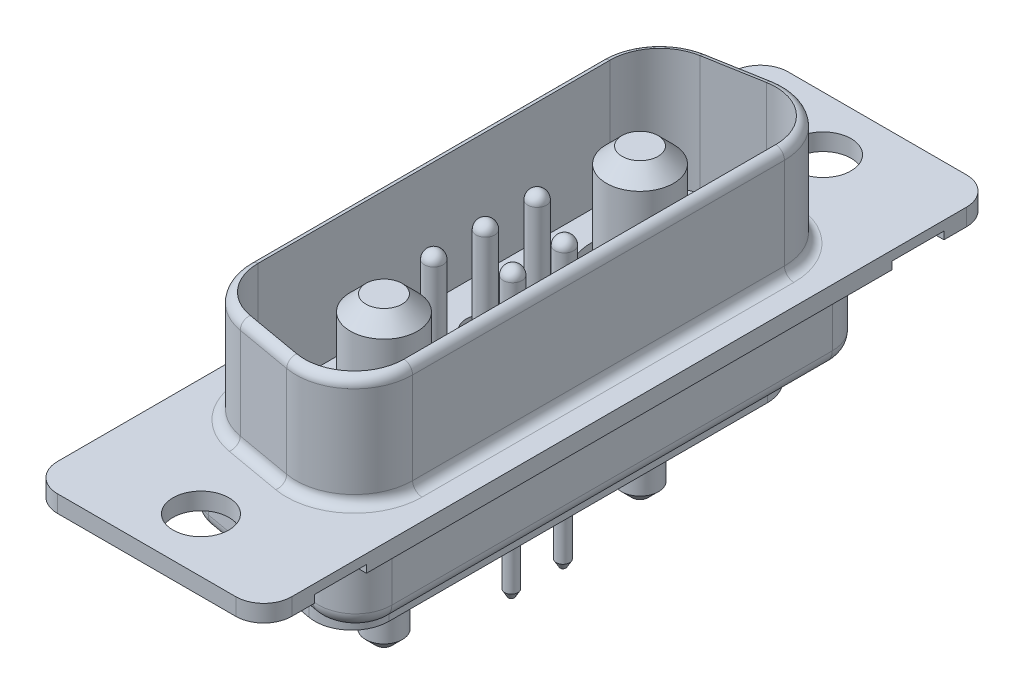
SolidWorks part; units mm, degrees
ref_plane "Front Plane" through (0, 0, 0) normal (0, 0, 1) x (1, 0, 0)
ref_plane "Top Plane" through (0, 0, 0) normal (0, 1, 0) x (1, 0, 0)
ref_plane "Right Plane" through (0, 0, 0) normal (1, 0, 0) x (0, 0, -1)
imported_body "Imported1"
sketch "Sketch1" plane through (0, 0, 0) normal (0, -1, 0) x (1, 0, 0)
  circle A0 centre (0, 16.6624) radius 2.519
  circle A1 centre (0, -16.6624) radius 2.3749
extrude "Cut-Extrude1" cut sketch "Sketch1" along normal through all
sketch "Sketch2" plane through (0, 0.9144, 0) normal (0, 1, 0) x (1, 0, 0)
  circle A0 centre (0, 16.6624) radius 2.3749
  circle A1 centre (0, -16.6624) radius 2.3749
extrude "Cut-Extrude2" cut sketch "Sketch2" along normal through all
sketch "Sketch5" plane through (0, 0, 0) normal (0, -1, 0) x (1, 0, 0)
  line L0 (0, 0) -> (0, 21.27) construction
  line L1 (0, 0) -> (11.075, 0) construction
  circle A0 centre (0, 16.6624) radius 1.4986
  circle A1 centre (0, -16.6624) radius 1.4986
  dimension "D1" = 2.9972
  dimension "D2" = 33.3248
extrude "Cut-Extrude3" cut sketch "Sketch5" against normal through all
